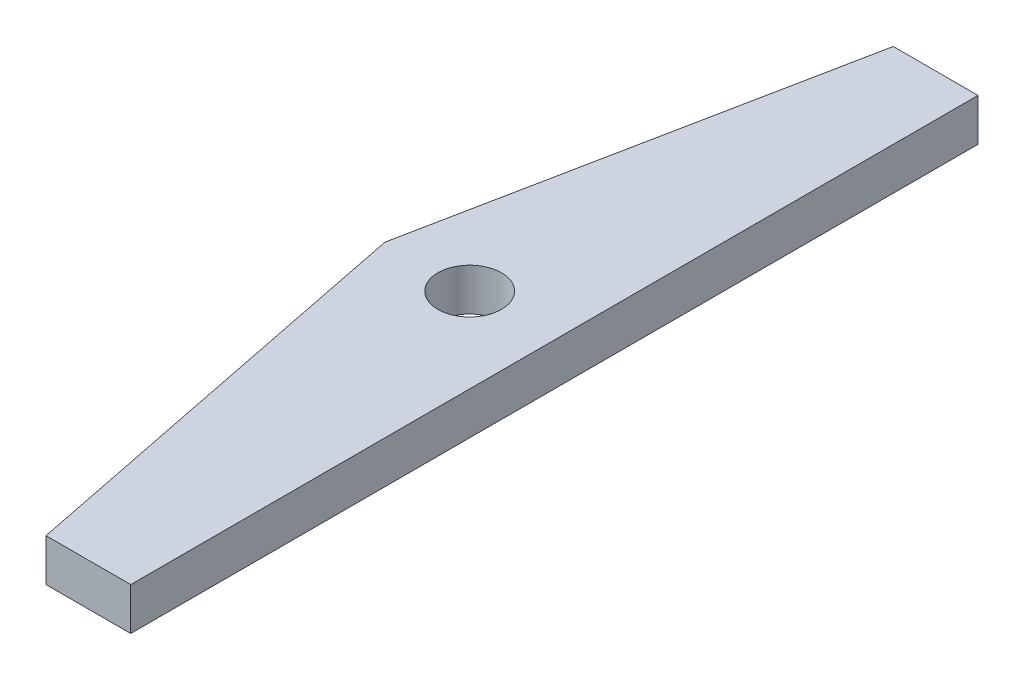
SolidWorks part; units mm, degrees
ref_plane "Front Plane" through (0, 0, 0) normal (0, 0, 1) x (1, 0, 0)
ref_plane "Top Plane" through (0, 0, 0) normal (0, 1, 0) x (1, 0, 0)
ref_plane "Right Plane" through (0, 0, 0) normal (1, 0, 0) x (0, 0, -1)
sketch "Sketch1" plane through (0, 0, 0) normal (0, 1, 0) x (1, 0, 0)
  line L0 (0, -30) -> (0, 30)
  line L1 (0, 30) -> (-6, 30)
  line L2 (-6, 30) -> (-12, 0)
  line L3 (-12, 0) -> (0, 0) construction
  line L4 (-6, -30) -> (-12, 0)
  line L5 (0, -30) -> (-6, -30)
  circle A0 centre (-6, 0) radius 2.25
  dimension "D3" = 4.5
  dimension "D4" = 6
  dimension "D5" = 30
  dimension "D1" = 12
  dimension "D2" = 6
extrude "Extrude1" add sketch "Sketch1" along normal blind 3
